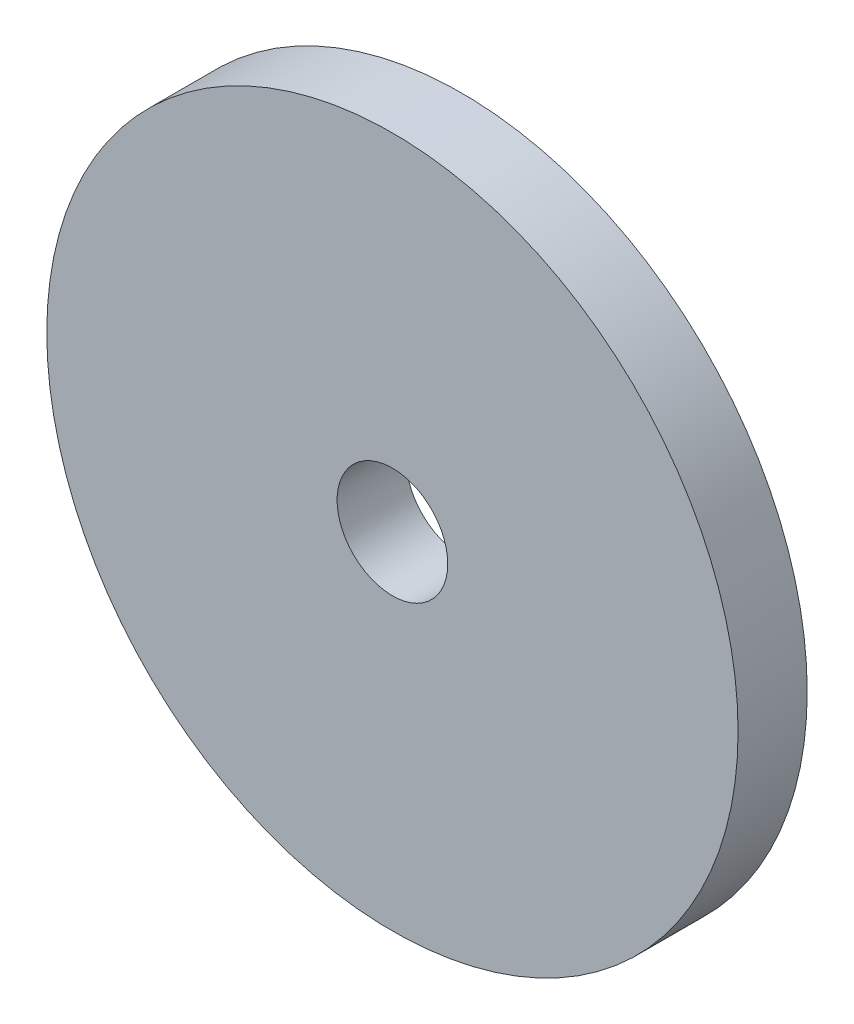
SolidWorks part; units mm, degrees
ref_plane "Front Plane" through (0, 0, 0) normal (0, 0, 1) x (1, 0, 0)
ref_plane "Top Plane" through (0, 0, 0) normal (0, 1, 0) x (1, 0, 0)
ref_plane "Right Plane" through (0, 0, 0) normal (1, 0, 0) x (0, 0, -1)
sketch "Sketch1" plane through (0, 0, 0) normal (0, 0, 1) x (1, 0, 0)
  circle A0 centre (0, 0) radius 25
  circle A1 centre (0, 0) radius 4
  dimension "D1" = 50
  dimension "D2" = 8
extrude "Boss-Extrude2" add sketch "Sketch1" along normal blind 5
